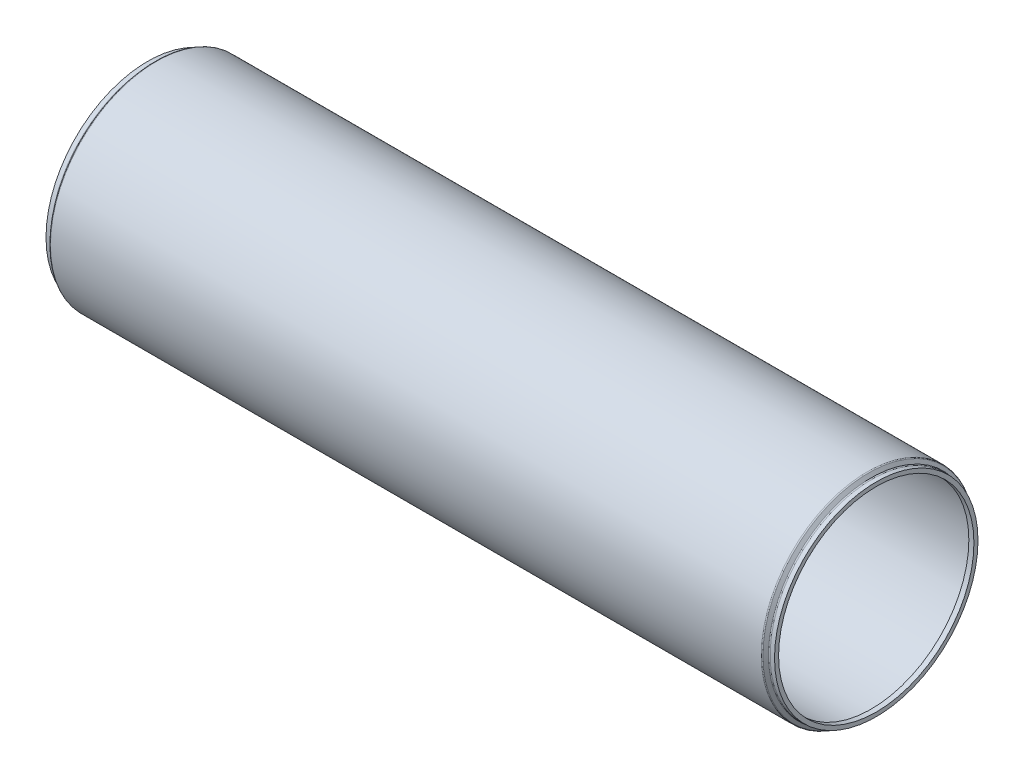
SolidWorks part; units mm, degrees
ref_plane "Front" through (0, 0, 0) normal (0, 0, 1) x (1, 0, 0)
ref_plane "Top" through (0, 0, 0) normal (0, 1, 0) x (1, 0, 0)
ref_plane "Right" through (0, 0, 0) normal (1, 0, 0) x (0, 0, -1)
sketch "Sketch1" plane through (0, 0, 0) normal (1, 0, 0) x (0, 0, -1)
  circle A0 centre (0, 0) radius 19.8755
  dimension "D1" = 39.751
extrude "Extrude-Thin1" add sketch "Sketch1" along normal blind 133.35 thin
sketch "Sketch2" plane through (0, 0, 0) normal (0, 0, 1) x (1, 0, 0)
  line L0 (-0.762, 19.05) -> (-0.5715, 19.05)
  line L1 (-0.762, 18.288) -> (-0.5715, 18.288)
  line L2 (0, 19.8755) -> (0, -19.8755) construction
  line L3 (-0.5715, 19.05) -> (0, 19.8755)
  line L4 (-0.5715, 18.288) -> (0, 19.1135)
  line L5 (0, 19.1135) -> (0, 19.8755)
  line L6 (-0.762, 19.05) -> (-0.762, 18.288)
  dimension "D1" = 0.762
  dimension "D2" = 0.762
  dimension "D3" = 19.05
  dimension "D4" = 0.1905
revolve "Revolve2" add sketch "Sketch2" angle 360 about axis through (133.35, 0, 0) along (-1, 0, 0)
fillet "Fillet1" radius 0.254 2 edges at (0, 0, -19.8755) (-0.5715, 0, -19.05)
sketch "Sketch3" plane through (-0.762, 0, 0) normal (-1, 0, 0) x (0, 0, 1)
  circle A0 centre (0, 0) radius 18.288
  circle A1 centre (0, 0) radius 19.05
extrude "Extrude1" add sketch "Sketch3" along normal blind 0.762
ref_plane "Plane1" through (66.675, 0, 0) normal (1, 0, 0) x (0, 0, -1)
mirror "Mirror2" about plane through (66.675, 0, 0) normal (1, 0, 0) of "Extrude1", "Fillet1", "Revolve2"
